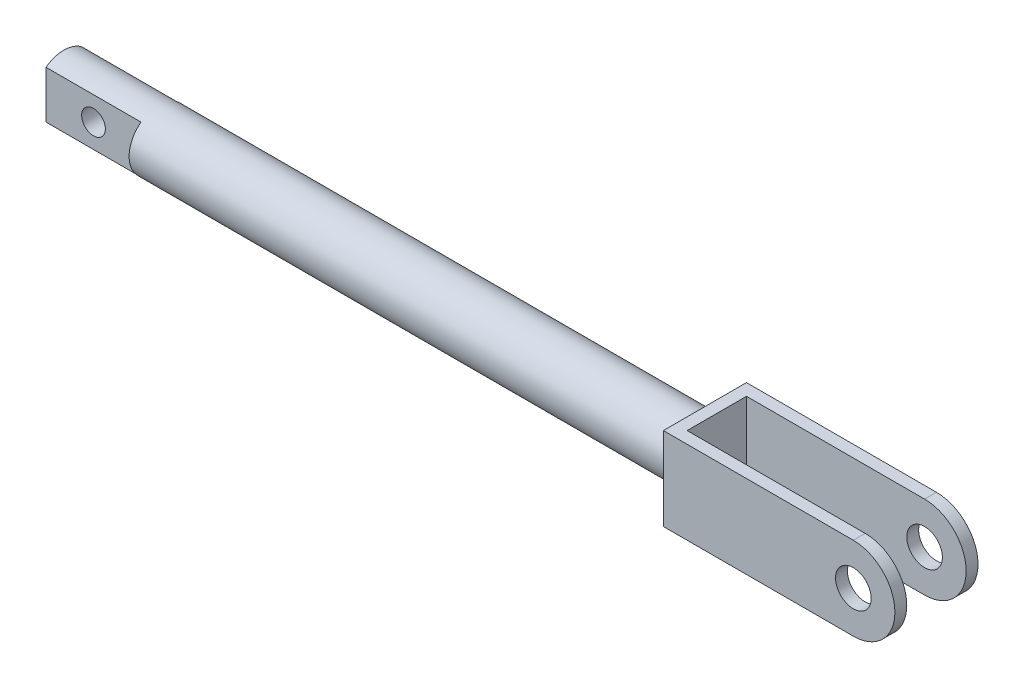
SolidWorks part; units mm, degrees
ref_plane "Front Plane" through (0, 0, 0) normal (0, 0, 1) x (1, 0, 0)
ref_plane "Top Plane" through (0, 0, 0) normal (0, 1, 0) x (1, 0, 0)
ref_plane "Right Plane" through (0, 0, 0) normal (1, 0, 0) x (0, 0, -1)
sketch "Sketch1" plane through (0, 0, 0) normal (1, 0, 0) x (0, 0, -1)
  circle A0 centre (0, 0) radius 12.5
  dimension "D1" = 25
sketch "Sketch2" plane through (0, 0, 0) normal (0, 0, 1) x (1, 0, 0)
  line L0 (0, 0) -> (250, 0) construction
  line L1 (220, 12.5) -> (220, -12.5) construction
  point P5 (220, 0)
  dimension "D1" = 250
  dimension "D2" = 220
  dimension "D3" = 25
extrude "Extrude1" add sketch "Sketch1" along normal blind 250 and the other way blind 20
sketch "Sketch3" plane through (0, 0, 0) normal (0, 0, 1) x (1, 0, 0)
  line L1 (250, 17.5) -> (250, -17.5)
  line L2 (0, 0) -> (250, 0) construction
  line L4 (250, 17.5) -> (330, 17.5)
  line L5 (330, -17.5) -> (250, -17.5)
  line L6 (250, -12.5) -> (250, 12.5) construction
  arc A0 (330, 17.5) -> (330, -17.5) centre (330, 0) cw
  circle A1 centre (330, 0) radius 7.5
  dimension "D3" = 80
  dimension "D4" = 15
  dimension "D1" = 17.5
  dimension "D2" = 17.5
extrude "Extrude2" add sketch "Sketch3" along normal mid plane 35
sketch "Sketch4" plane through (0, 17.5, 0) normal (0, 1, 0) x (-1, 0, 0)
  line L5 (-347.5, -12.5) -> (-347.5, 12.5)
  line L6 (20, -7.5) -> (-20, -7.5)
  line L7 (20, -12.5) -> (20, 12.5) construction
  line L8 (-20, -7.5) -> (-20, -12.5)
  line L9 (20, -7.5) -> (20, -12.5)
  line L10 (-330, 12.5) -> (-347.5, 12.5)
  line L11 (-255, 12.5) -> (-330, 12.5)
  line L12 (-330, -12.5) -> (-255, -12.5)
  line L13 (-255, -12.5) -> (-255, 12.5)
  line L14 (-347.5, -12.5) -> (-330, -12.5)
  line L15 (-330, 12.5) -> (-347.5, 12.5)
  line L16 (-255, 12.5) -> (-330, 12.5)
  line L17 (-330, -12.5) -> (-255, -12.5)
  line L18 (-255, -12.5) -> (-255, 12.5)
  line L19 (-347.5, -12.5) -> (-330, -12.5)
  line L20 (20, -12.5) -> (-20, -12.5)
  line L21 (0, 0) -> (37.8425, 0) construction
  line L22 (20, 12.5) -> (-20, 12.5)
  line L23 (20, 7.5) -> (20, 12.5)
  line L24 (-20, 7.5) -> (-20, 12.5)
  line L25 (20, 7.5) -> (-20, 7.5)
  dimension "D2" = 5
  dimension "D3" = 40
  dimension "D1" = 5
extrude "Cut-Extrude1" cut sketch "Sketch4" against normal through all
sketch "Sketch6" plane through (0, 0, 7.5) normal (0, 0, 1) x (1, 0, 0)
  circle A0 centre (0, 0) radius 5
  dimension "D1" = 10
extrude "Cut-Extrude2" cut sketch "Sketch6" against normal through all
